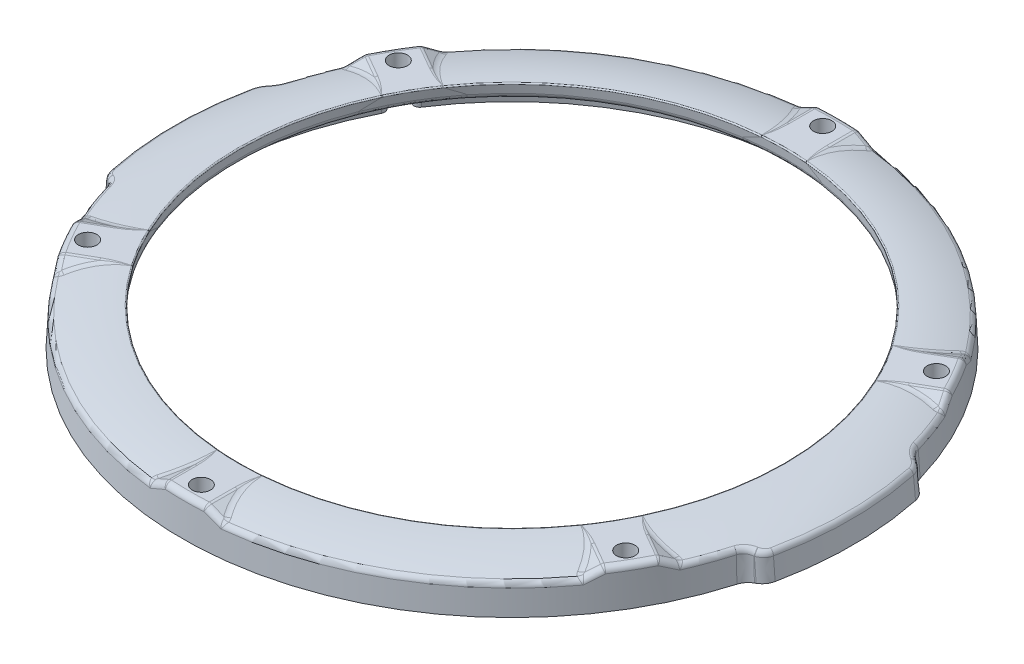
SolidWorks part; units mm, degrees
other "<WTE4-P-DOME-RETAINING-RING-R1>-<Fillet9>"
ref_plane "Front Plane" through (0, 0, 0) normal (0, 0, 1) x (1, 0, 0)
ref_plane "Top Plane" through (0, 0, 0) normal (0, 1, 0) x (1, 0, 0)
ref_plane "Right Plane" through (0, 0, 0) normal (1, 0, 0) x (0, 0, -1)
inserted part "WTE4-P-DOME-RETAINING-RING-R1"
